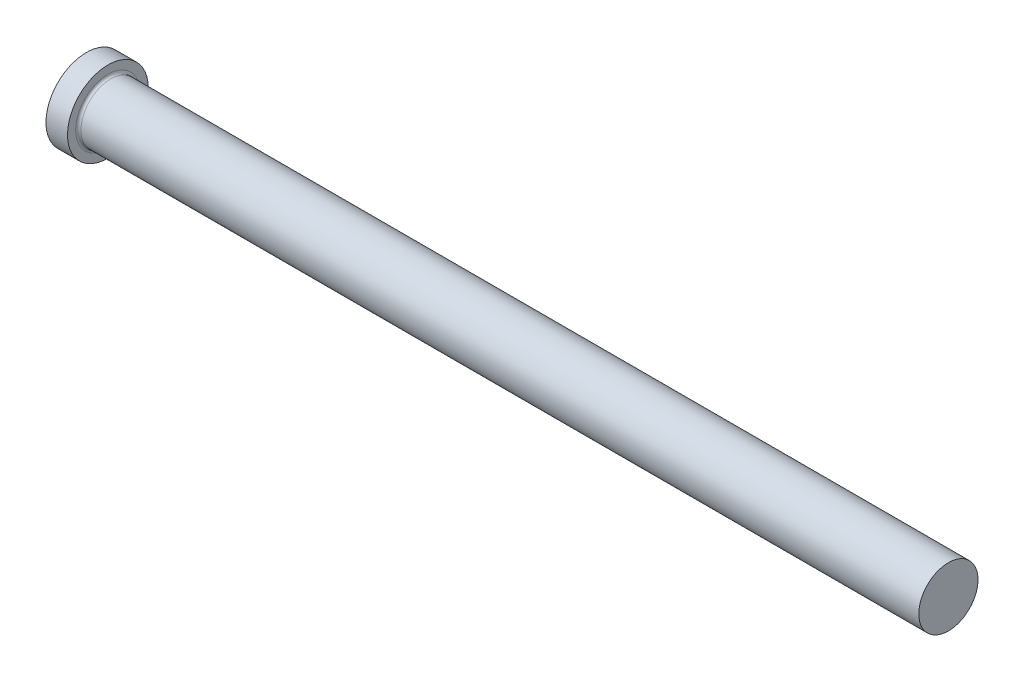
SolidWorks part; units mm, degrees
ref_plane "Front Plane" through (0, 0, 0) normal (0, 0, 1) x (1, 0, 0)
ref_plane "Top Plane" through (0, 0, 0) normal (0, 1, 0) x (1, 0, 0)
ref_plane "Right Plane" through (0, 0, 0) normal (1, 0, 0) x (0, 0, -1)
sketch "Sketch1" plane through (0, 0, 0) normal (0, 0, 1) x (1, 0, 0)
  line L0 (0, 0) -> (0, 11.9062)
  line L1 (0, 11.9062) -> (6.35, 11.9062)
  line L2 (6.35, 11.9062) -> (6.35, 9.5123)
  line L3 (7.1374, 8.7249) -> (254, 8.7249)
  line L4 (254, 8.7249) -> (254, 0)
  line L5 (254, 0) -> (0, 0)
  line L6 (254, 0) -> (0, 0) construction
  line L7 (0, 0) -> (-10.4771, 0) construction
  line L8 (254, 0) -> (1002.3976, 0) construction
  arc A0 (7.1374, 8.7249) -> (6.35, 9.5123) centre (7.1374, 9.5123) cw
  dimension "D1" = 0.7874
  dimension "HeadDia" = 23.8125
  dimension "HeadThickness" = 6.35
  dimension "PinDia" = 17.4498
  dimension "overall" = 254
revolve "PIN" add sketch "Sketch1" angle 360 about L6
